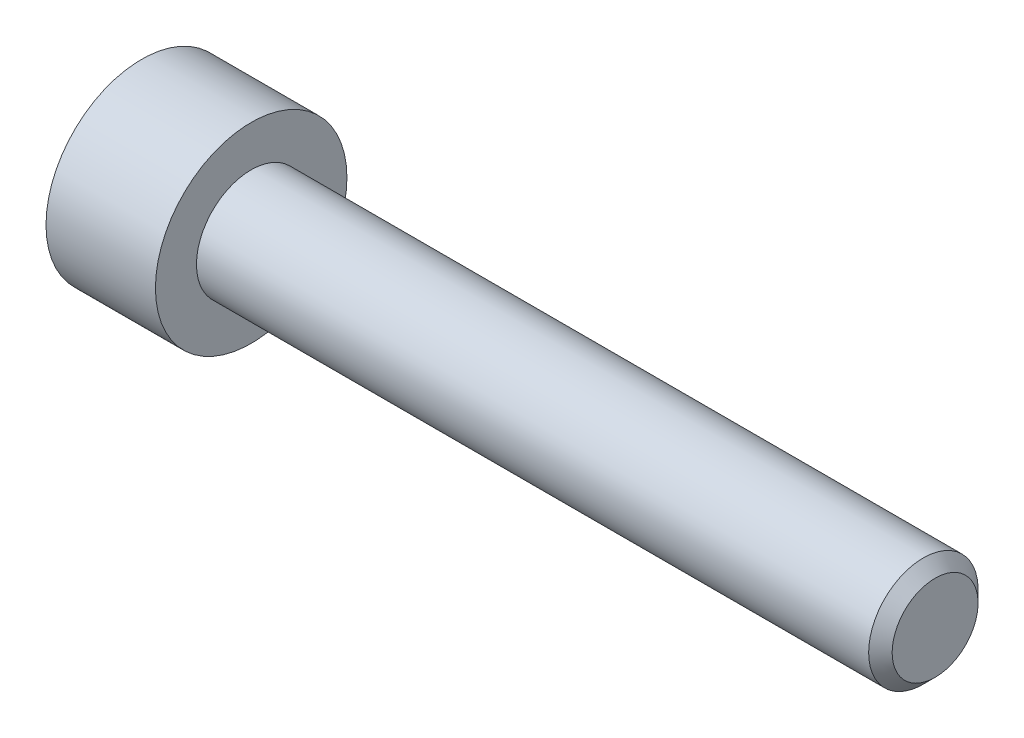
SolidWorks part; units mm, degrees
ref_plane "Face" through (0, 0, 0) normal (0, 0, 1) x (1, 0, 0)
ref_plane "Dessus" through (0, 0, 0) normal (0, 1, 0) x (1, 0, 0)
ref_plane "Droite" through (0, 0, 0) normal (1, 0, 0) x (0, 0, -1)
ref_plane "Plan1" through (0, 0, 0) normal (0, 0, 1) x (1, 0, 0)
sketch "Esquisse1" plane through (0, 0, 0) normal (0, 0, 1) x (1, 0, 0)
  line L0 (-4, 0) -> (-4, 3.5)
  line L1 (-4, 3.5) -> (0, 3.5)
  line L2 (0, 3.5) -> (0, 2)
  line L3 (0, 2) -> (24.5705, 2)
  line L4 (24.5705, 2) -> (25, 1.5705)
  line L5 (25, 1.5705) -> (25, 0)
  line L6 (25, 0) -> (-4, 0)
  line L7 (25, 0) -> (-4, 0) construction
revolve "Révolution1" add sketch "Esquisse1" angle 360 about L7
ref_plane "Plan2" through (-4, 0, 0) normal (1, 0, 0) x (0, 0, -1)
sketch "Esquisse2" plane through (-4, 0, 0) normal (1, 0, 0) x (0, 0, -1)
  line L0 (-1.5, 0.866) -> (-1.5, -0.866)
  line L1 (-1.5, -0.866) -> (0, -1.7321)
  line L2 (0, -1.7321) -> (1.5, -0.866)
  line L3 (1.5, -0.866) -> (1.5, 0.866)
  line L4 (1.5, 0.866) -> (0, 1.7321)
  line L5 (0, 1.7321) -> (-1.5, 0.866)
extrude "Enlèv. mat.-Extru.1" cut sketch "Esquisse2" along normal blind 2
ref_plane "Plan3" through (0, 0, 0) normal (0, 0, 1) x (1, 0, 0)
sketch "Esquisse3" plane through (0, 0, 0) normal (0, 0, 1) x (1, 0, 0)
  line L0 (-2, 0) -> (-2, 1.49)
  line L1 (-2, 1.49) -> (-1.1397, 0)
  line L2 (-1.1397, 0) -> (-2, 0)
  line L3 (-1.1397, 0) -> (-2, 0) construction
revolve "Enlèvement de matière-Révolution1" cut sketch "Esquisse3" angle 360 about L3
